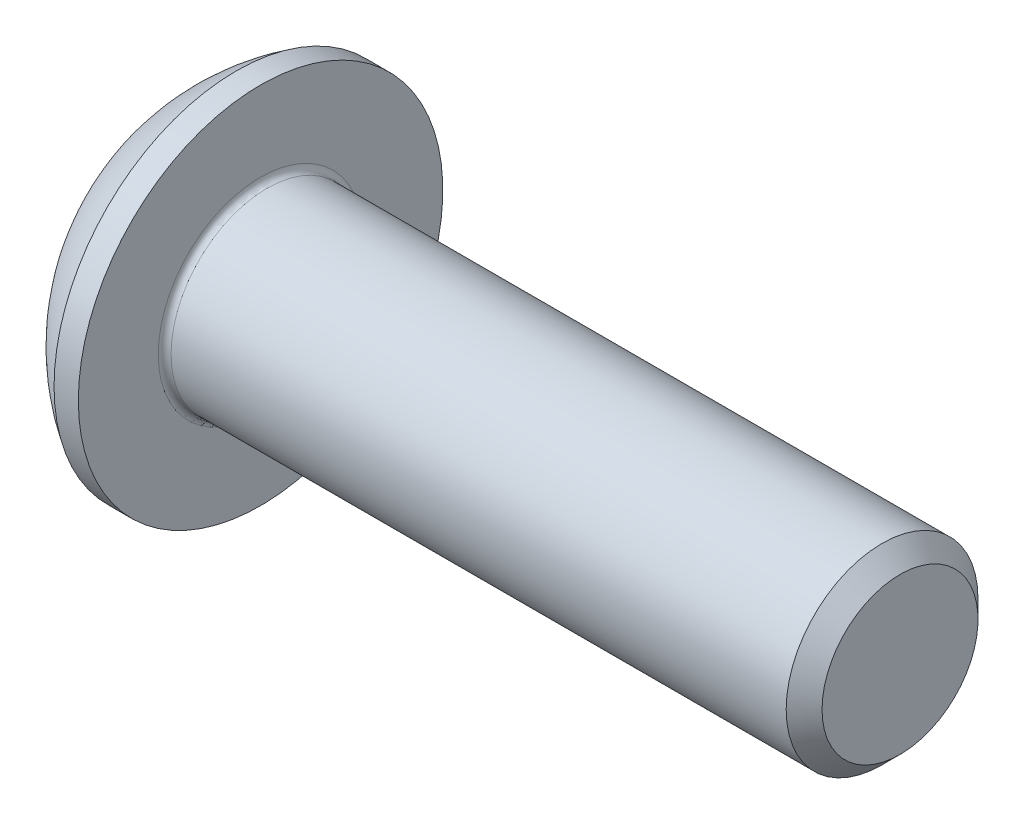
SolidWorks part; units mm, degrees
ref_plane "Plane1" through (0, 0, 0) normal (0, 0, 1) x (1, 0, 0)
ref_plane "Plane2" through (0, 0, 0) normal (0, 1, 0) x (1, 0, 0)
ref_plane "Plane3" through (0, 0, 0) normal (1, 0, 0) x (0, 0, -1)
other "Configuration Table"
sketch "BodySke" plane through (0, 0, 0) normal (0, 0, 1) x (1, 0, 0)
  line L0 (11.65, 0) -> (11.65, 1.2195)
  line L1 (11.3695, 1.5) -> (1.65, 1.5)
  line L2 (1.65, 1.5) -> (1.65, 2.85)
  line L3 (1.65, 2.85) -> (1.27, 2.85)
  line L4 (0, 0) -> (101.6, 0) construction
  line L5 (1.65, -2.85) -> (1.27, -2.85) construction
  line L6 (55.6768, -1.5) -> (1.65, -1.5) construction
  line L7 (11.65, 0) -> (0, 0)
  line L8 (0, 1.425) -> (0, -1.425) construction
  line L9 (0, 0) -> (0, 1.425)
  line L10 (11.65, 1.2195) -> (11.3695, 1.5)
  line L11 (11.65, -1.2195) -> (11.3695, -1.5) construction
  line L12 (2.15, 9.525) -> (2.15, -1.5) construction
  line L13 (1.65, 9.525) -> (1.65, -1.5) construction
  arc A1 (0, 1.425) -> (1.27, 2.85) centre (3.0334, 0) cw
revolve "BaseBody" add sketch "BodySke" angle 360 about L4
fillet "Fillet1" radius 0.1 1 edges at (1.65, 0, 1.5)
sketch "Sketch2" plane through (0, 0, 0) normal (0, 0, 1) x (1, 0, 0)
  line L0 (0, 1) -> (1.04, 1)
  line L1 (1.04, 1) -> (1.6174, 0)
  line L3 (1.6174, 0) -> (0, 0)
  line L4 (0, 0) -> (0, 1)
  line L5 (0, -1) -> (1.04, -1) construction
  line L6 (0, 0) -> (47.625, 0) construction
  dimension "D2" = 60
  dimension "PreBroach_depth" = 1.04
  dimension "PreBroach_dia" = 2
revolve "PreBroach" cut sketch "Sketch2" angle 360 about L6
sketch "Sketch3" plane through (0, 0, 0) normal (1, 0, 0) x (0, 0, -1)
  line L0 (-1, -0.5774) -> (-1, 0.5774)
  line L1 (-1, 0.5774) -> (0, 1.1547)
  line L2 (0, 1.1547) -> (1, 0.5774)
  line L3 (1, 0.5774) -> (1, -0.5774)
  line L4 (1, -0.5774) -> (0, -1.1547)
  line L5 (0, -1.1547) -> (-1, -0.5774)
extrude "Hex" cut sketch "Sketch3" along normal blind 1.04
sketch "ThdSchSke" plane through (0, 0, 0) normal (0, 0, 1) x (1, 0, 0)
  line L0 (2.65, -1.2195) -> (2.4536, -1.5)
  line L1 (2.65, -1.2195) -> (2.8464, -1.5)
  line L2 (2.8464, -1.5) -> (2.8464, -1.875)
  line L3 (-3.175, 0) -> (5.1513, 0) construction
  line L5 (2.8464, -1.875) -> (2.4536, -1.875)
  line L6 (2.4536, -1.875) -> (2.4536, -1.5)
revolve "ThreadSchematic" [suppressed] cut sketch "ThdSchSke" angle 360 about L3
pattern_linear "ThdSchPat" [suppressed]
equation "\"D1@BodySke\" = \"Head_dia@BodySke\" * .5"
equation "\"Thread_minor@ThreadCosmetic\" = \"Minor_dia@BodySke\""
equation "\"D1@Sketch3\" = \"Hex_size@Sketch3\" / 2"
equation "\"D2@Sketch3\" = \"D1@Sketch3\""
equation "\"D3@Sketch3\" = \"Hex_size@Sketch3\""
equation "\"Thread_length@ThreadCosmetic\" = ((sgn( (\"Length@BodySke\" - \"Advance@BodySke\" * 2.0) - \"Thread_nom@BodySke\" )-1)*( (\"Length@BodySke\" - \"Advance@BodySke\" * 2.0) - \"Thread_nom@BodySke\" ))/-2+ \"Thread_no"
equation "\"Thread_minor@ThdSchSke\" = \"Minor_dia@BodySke\""
equation "\"Diameter@ThdSchSke\" = \"Diameter@BodySke\""
equation "\"Overcut@ThdSchSke\" = \"Diameter@BodySke\" * 1.25"
equation "\"Start@ThdSchSke\" = \"Head_ht@BodySke\" + \"Length@BodySke\" - \"Thread_length@ThreadCosmetic\"  '---Non-countersunk---"
equation "\"Num_threads@ThdSchPat\" = int( \"Thread_length@ThreadCosmetic\" / \"Advance@BodySke\" + 0.999 )  + 1"
equation "\"Advance@ThdSchPat\" = \"Thread_length@ThreadCosmetic\" /  (\"Num_threads@ThdSchPat\" - 1) 'relax it"
equation "\"Num_threads@ThdSchPat\" = \"Num_threads@ThdSchPat\" - sgn( \"Num_threads@ThdSchPat\" - 1) '---chamfered tips only---"
